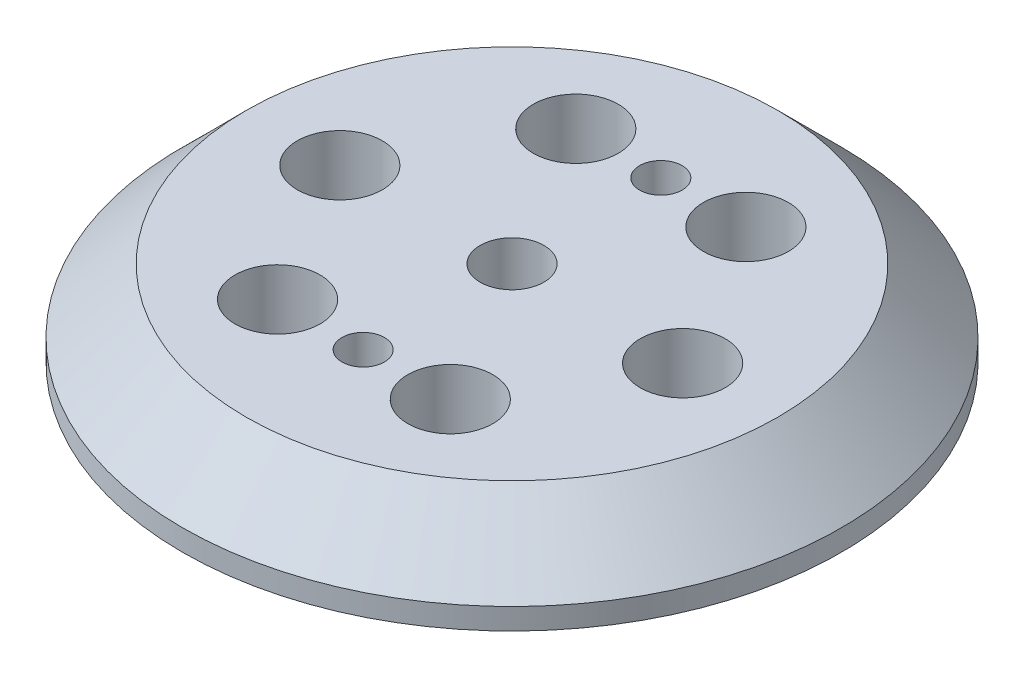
SolidWorks part; units mm, degrees
ref_plane "Front Plane" through (0, 0, 0) normal (0, 0, 1) x (1, 0, 0)
ref_plane "Top Plane" through (0, 0, 0) normal (0, 1, 0) x (1, 0, 0)
ref_plane "Right Plane" through (0, 0, 0) normal (1, 0, 0) x (0, 0, -1)
sketch "Sketch1" plane through (0, 0, 0) normal (0, 1, 0) x (1, 0, 0)
  circle A0 centre (0, 0) radius 15.5
  dimension "D1" = 31
extrude "Boss-Extrude1" add sketch "Sketch1" along normal blind 4
chamfer "Chamfer1" distance 3 angle 45 1 edges at (0, 4, 15.5)
sketch "Sketch2" plane through (0, 4, 0) normal (0, 1, 0) x (1, 0, 0)
  line L0 (0, 0) -> (0, 7) construction
  line L1 (0, 7) -> (4.5163, 7) construction
  circle A0 centre (0, 0) radius 8.25 construction
  circle A1 centre (4, 7) radius 2
  circle A2 centre (-4, 7) radius 2
  circle A3 centre (8.0622, -0.0359) radius 2
  circle A4 centre (4.0622, -6.9641) radius 2
  circle A5 centre (-4.0622, -6.9641) radius 2
  circle A6 centre (-8.0622, -0.0359) radius 2
  point P21 (0, 0)
  dimension "D1" = 16.5
  dimension "D3" = 4
  dimension "D4" = 4
  dimension "D2" = 7
  dimension "D5" = 4
  dimension "D6" = 4
  dimension "D7" = 3
extrude "Cut-Extrude1" cut sketch "Sketch2" against normal blind 4
sketch "Sketch3" plane through (0, 4, 0) normal (0, 1, 0) x (1, 0, 0)
  circle A0 centre (0, 0) radius 1.5
  dimension "D1" = 3
extrude "Cut-Extrude2" cut sketch "Sketch3" against normal blind 4
sketch "Sketch4" plane through (0, 4, 0) normal (0, 1, 0) x (1, 0, 0)
  line L0 (0, 0.5494) -> (0, 7.4482) construction
  circle A0 centre (0, 7) radius 1
  circle A1 centre (0, -7) radius 1
  dimension "D1" = 2
  dimension "D2" = 2
  dimension "D3" = 7
  dimension "D4" = 7
extrude "Cut-Extrude3" cut sketch "Sketch4" against normal blind 4
